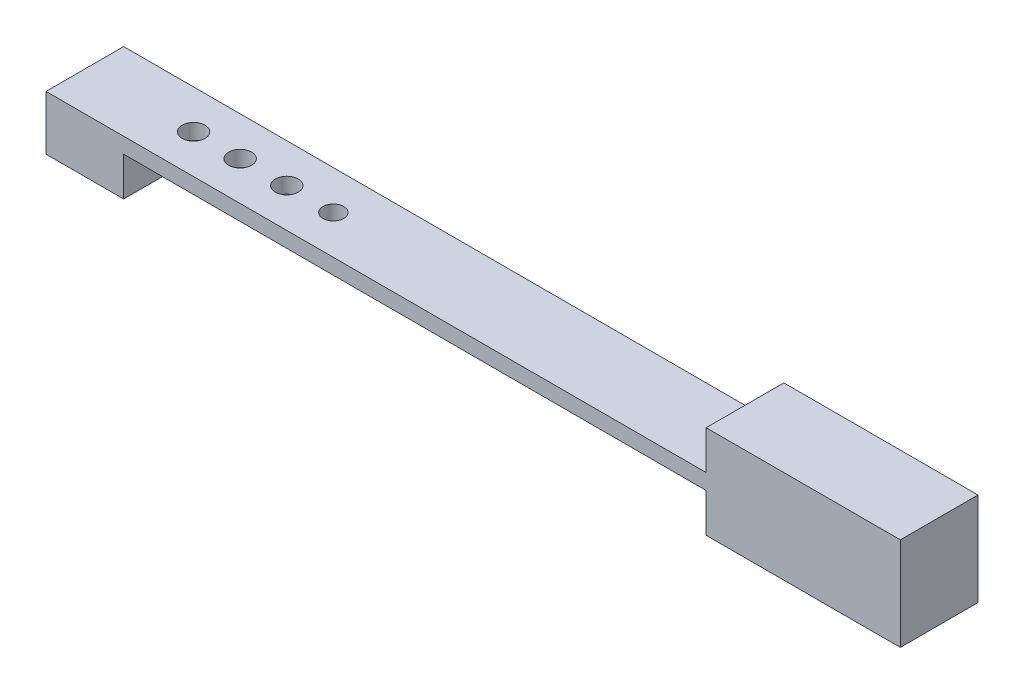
SolidWorks part; units mm, degrees
ref_plane "Front Plane" through (0, 0, 0) normal (0, 0, 1) x (1, 0, 0)
ref_plane "Top Plane" through (0, 0, 0) normal (0, 1, 0) x (1, 0, 0)
ref_plane "Right Plane" through (0, 0, 0) normal (1, 0, 0) x (0, 0, -1)
sketch "Sketch1" plane through (0, 0, 0) normal (0, 1, 0) x (1, 0, 0)
  line L1 (-110, 10) -> (110, 10)
  line L2 (-110, 10) -> (-110, -10)
  line L3 (-110, -10) -> (110, -10)
  line L4 (110, 10) -> (110, -10)
  line L5 (-110, 10) -> (110, -10) construction
  line L6 (-110, -10) -> (110, 10) construction
  point P0 (0, 0)
  dimension "D1" = 20
  dimension "D2" = 220
extrude "Boss-Extrude1" add sketch "Sketch1" along normal blind 4
sketch "Sketch2" plane through (0, 4, 0) normal (0, 1, 0) x (1, 0, 0)
  line L0 (-110, -2.7329) -> (-70, -2.7329) construction
  line L1 (-110, 10) -> (-110, -10) construction
  line L2 (-70, 10) -> (-70, -10) construction
  line L3 (110, 10) -> (-110, 10) construction
  line L4 (-110, -10) -> (110, -10) construction
  line L5 (-70, 0) -> (110, 0) construction
  line L6 (110, -10) -> (110, 10) construction
  circle A0 centre (-70, 0) radius 2.95
  circle A1 centre (-58, 0) radius 2.95
  circle A2 centre (-46, 0) radius 2.6755
  circle A3 centre (-82, 0) radius 2.95
  dimension "D2" = 5.9
  dimension "D3" = 12
  dimension "D4" = 12
  dimension "D5" = 12
  dimension "D1" = 40
extrude "Cut-Extrude1" cut sketch "Sketch2" against normal blind 4
sketch "Sketch3" plane through (0, 4, 0) normal (0, 1, 0) x (1, 0, 0)
  line L0 (-110, -10) -> (110, -10) construction
  line L1 (110, 10) -> (60, 10)
  line L2 (110, 10) -> (110, -10)
  line L3 (110, -10) -> (60, -10)
  line L4 (60, 10) -> (60, -10)
  dimension "D1" = 50
extrude "Boss-Extrude2" add sketch "Sketch3" along normal blind 10
sketch "Sketch4" plane through (0, 0, 0) normal (0, -1, 0) x (1, 0, 0)
  line L0 (110, -10) -> (-110, -10) construction
  line L1 (110, 10) -> (60, 10)
  line L2 (110, 10) -> (110, -10)
  line L3 (110, -10) -> (60, -10)
  line L4 (60, 10) -> (60, -10)
  dimension "D1" = 50
extrude "Boss-Extrude3" add sketch "Sketch4" along normal blind 10
sketch "Sketch5" plane through (0, 0, 0) normal (0, -1, 0) x (1, 0, 0)
  line L0 (60, -10) -> (-110, -10) construction
  line L1 (-110, 10) -> (-90, 10)
  line L2 (-110, 10) -> (-110, -10)
  line L3 (-110, -10) -> (-90, -10)
  line L4 (-90, 10) -> (-90, -10)
  dimension "D1" = 20
extrude "Boss-Extrude4" add sketch "Sketch5" along normal blind 10
